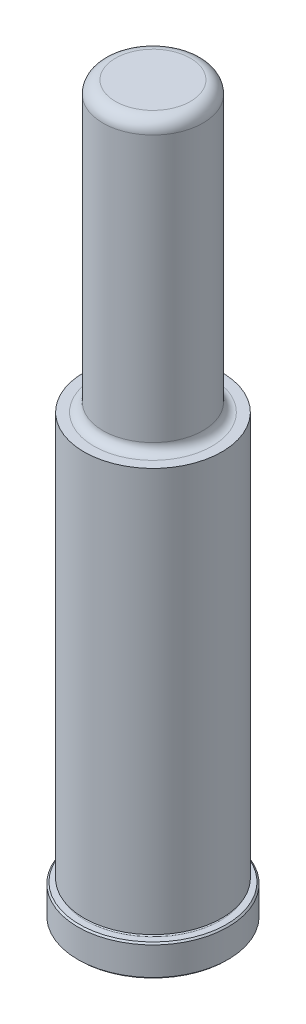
SolidWorks part; units mm, degrees
ref_plane "Front Plane" through (0, 0, 0) normal (0, 0, 1) x (1, 0, 0)
ref_plane "Top Plane" through (0, 0, 0) normal (0, 1, 0) x (1, 0, 0)
ref_plane "Right Plane" through (0, 0, 0) normal (1, 0, 0) x (0, 0, -1)
sketch "Sketch1" plane through (0, 0, 0) normal (1, 0, 0) x (0, 0, -1)
  line L0 (0, 0) -> (19.05, 0)
  line L1 (19.05, 0) -> (19.05, 7.9248)
  line L2 (19.05, 7.9248) -> (17.0688, 7.9248)
  line L3 (16.6878, 2.6782) -> (16.6878, 5.9795) construction
  line L4 (17.0688, 8.6868) -> (17.4752, 8.6868)
  line L5 (17.4752, 8.6868) -> (17.4752, 111.125)
  line L6 (17.4752, 111.125) -> (14.9733, 111.125)
  line L7 (12.6873, 113.411) -> (12.6873, 184.15)
  line L9 (12.6873, 184.15) -> (0, 184.15)
  line L10 (0, 184.15) -> (0, 0)
  line L11 (0, 0) -> (0, -7.2694) construction
  arc A0 (17.0688, 8.6868) -> (17.0688, 7.9248) centre (17.0688, 8.3058) ccw
  arc A1 (14.9733, 111.125) -> (12.6873, 113.411) centre (14.9733, 113.411) cw
  point P2 (12.6873, 184.15)
  point P14 (12.6873, 184.7819)
  point P19 (12.6873, 111.125)
  dimension "D14" = 0.762
  dimension "D8" = 2.286
  dimension "T" = 7.9248
  dimension "D2" = 0.762
  dimension "M" = 38.1
  dimension "B" = 34.9504
  dimension "L" = 184.15
  dimension "D7" = 0.7874
  dimension "A" = 111.125
  dimension "D" = 25.3746
  dimension "D15" = 73.025
revolve "Revolve1" add sketch "Sketch1" angle 360 about L11
chamfer "Chamfer1" distance 0.381 angle 45 2 edges at (0, 0, 19.05) (0, 7.9248, 19.05)
fillet "Fillet7" radius 3.175 1 edges at (0, 184.15, 12.6873)
